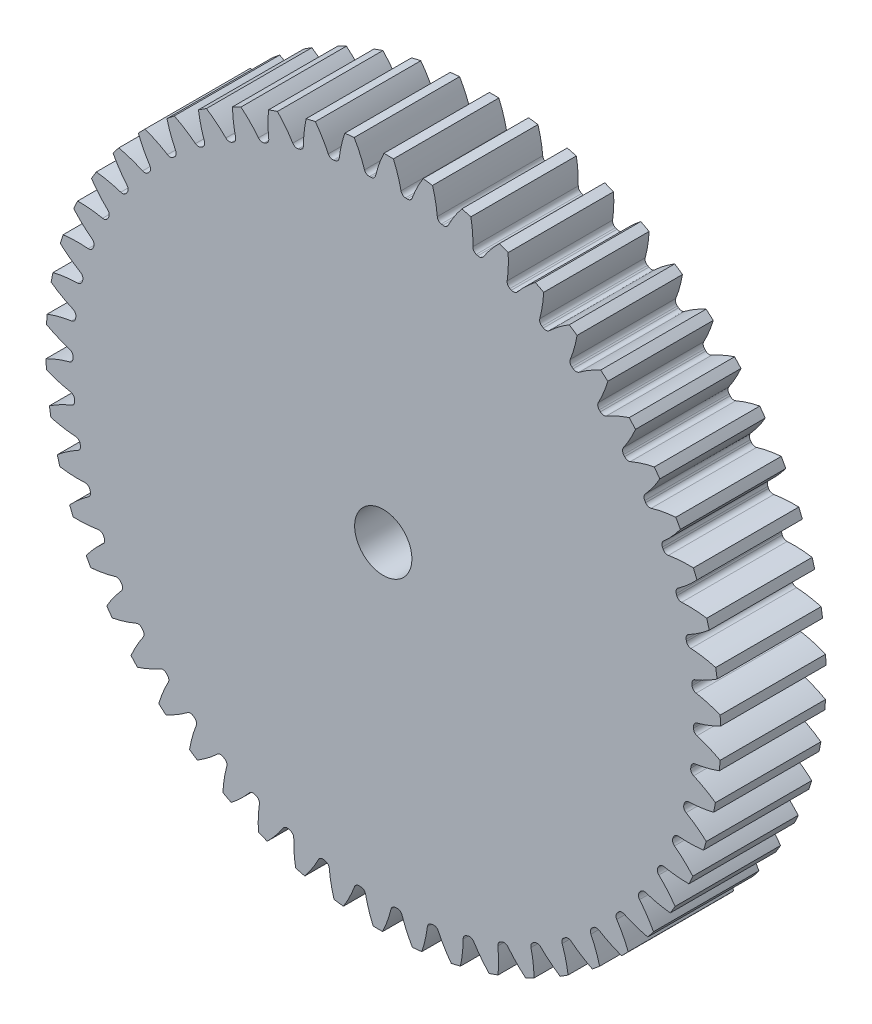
SolidWorks part; units mm, degrees
ref_plane "Front" through (0, 0, 0) normal (0, 0, 1) x (1, 0, 0)
ref_plane "Top" through (0, 0, 0) normal (0, 1, 0) x (1, 0, 0)
ref_plane "Right" through (0, 0, 0) normal (1, 0, 0) x (0, 0, -1)
sketch "Sketch3" plane through (0, 0, 0) normal (0, 0, 1) x (1, 0, 0)
  circle A0 centre (0, 0) radius 284.48
  dimension "od" = 568.96
extrude "gearBody" add sketch "Sketch3" along normal blind 88.9
sketch "Sketch2" plane through (0, 0, 0) normal (0, 0, 1) x (1, 0, 0)
  line L0 (0, 0) -> (238.1544, 98.6468) construction
  line L1 (284.075, -17.1896) -> (0, 0) construction
  line L2 (0, 0) -> (36.3143, 0) construction
  line L3 (274.297, 3.5512) -> (274.0422, -12.3425) construction
  line L5 (274.1696, -4.3956) -> (0, 0) construction
  line L7 (0, 0) -> (257.7765, 0) construction
  arc A0 (257.7738, -1.1757) -> (257.679, -7.0883) centre (0, 0) ccw construction
  arc A1 (284.367, 8.0165) -> (283.9639, -17.1283) centre (0, 0) ccw construction
  arc A2 (274.297, 3.5512) -> (274.0422, -12.3425) centre (0, 0) ccw construction
  arc A3 (261.5745, -4.8774) -> (261.5964, -3.5104) centre (0, 0) ccw
  arc A4 (284.075, -17.1896) -> (264.5044, -8.9103) centre (234.8697, -106.2306) ccw
  arc A5 (284.075, -17.1896) -> (284.48, 8.0742) centre (0, 0) ccw
  arc A6 (284.48, 8.0742) -> (264.6541, 0.4265) centre (238.1544, 98.6468) cw
  arc A7 (261.5964, -3.5104) -> (264.6541, 0.4265) centre (265.7312, -3.5658) cw
  arc A8 (264.5044, -8.9103) -> (261.5745, -4.8774) centre (265.7089, -4.9545) cw
  point P6 (284.48, 8.0742)
  point P22 (284.075, -17.1896)
  dimension "baseDia" = 515.553
  dimension "od" = 568.96
  dimension "pd" = 548.64
  dimension "rd" = 523.24
  dimension "rFillet" = 4.1351
  dimension "pointX" = 284.48
  dimension "pointY" = 8.0742
  dimension "CTT" = 15.8937
  dimension "flankCenterAngle" = 22.5
extrude "toothCut" cut sketch "Sketch2" along normal through all
pattern_circular "CirPattern1" count 54 over 360 about axis through (0, 0, 0) along (0, 0, 1) of "toothCut"
sketch "hub1Dia" plane through (0, 0, 0) normal (0, 0, -1) x (-1, 0, 0)
  circle A0 centre (0, 0) radius 12.7
  dimension "hub1Dia" = 25.4
sketch "hub2Dia" plane through (0, 0, 88.9) normal (0, 0, 1) x (1, 0, 0)
  circle A0 centre (0, 0) radius 12.7
  dimension "hub2dia" = 25.4
sketch "boreDia" plane through (0, 0, 0) normal (0, 0, 1) x (1, 0, 0)
  circle A0 centre (0, 0) radius 24.13
  dimension "boreDia" = 48.26
extrude "bore" cut sketch "boreDia" against normal mid plane 25400
